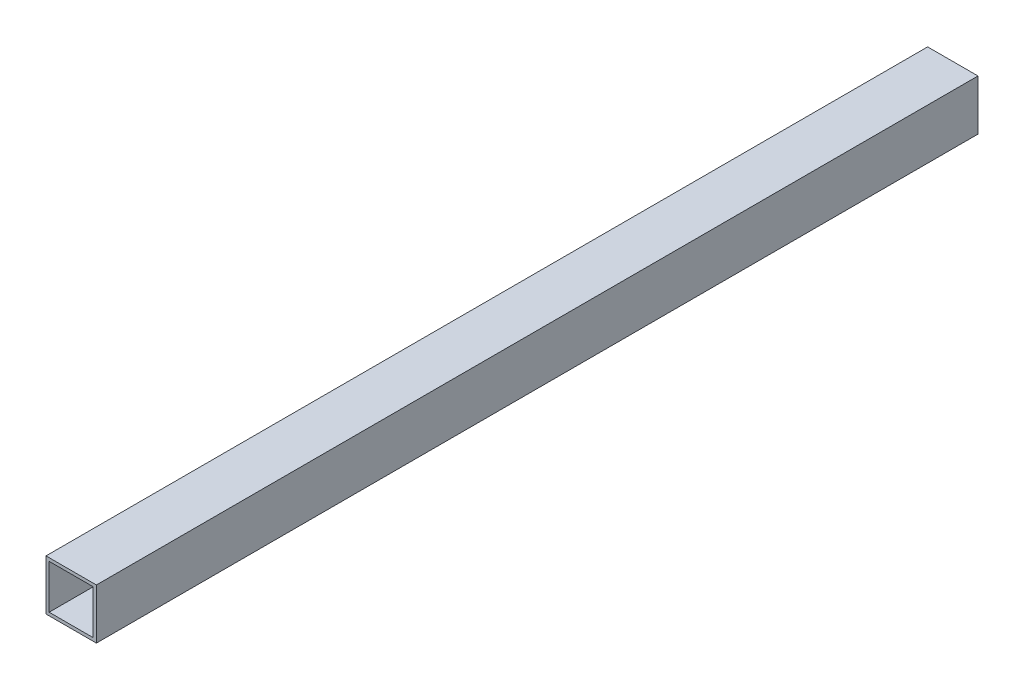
SolidWorks part; units mm, degrees
ref_plane "Front Plane" through (0, 0, 0) normal (0, 0, 1) x (1, 0, 0)
ref_plane "Top Plane" through (0, 0, 0) normal (0, 1, 0) x (1, 0, 0)
ref_plane "Right Plane" through (0, 0, 0) normal (1, 0, 0) x (0, 0, -1)
sketch "Sketch1" plane through (0, 0, 0) normal (0, 0, 1) x (1, 0, 0)
  line L0 (1.5875, 23.8125) -> (23.8125, 23.8125)
  line L1 (0, 0) -> (25.4, 0)
  line L2 (0, 0) -> (0, 25.4)
  line L3 (0, 25.4) -> (25.4, 25.4)
  line L4 (25.4, 0) -> (25.4, 25.4)
  line L5 (23.8125, 1.5875) -> (23.8125, 23.8125)
  line L6 (1.5875, 1.5875) -> (23.8125, 1.5875)
  line L7 (1.5875, 1.5875) -> (1.5875, 23.8125)
  dimension "D1" = 25.4
  dimension "D2" = 25.4
  dimension "D3" = 1.5875
extrude "Boss-Extrude1" add sketch "Sketch1" along normal blind 444.5
